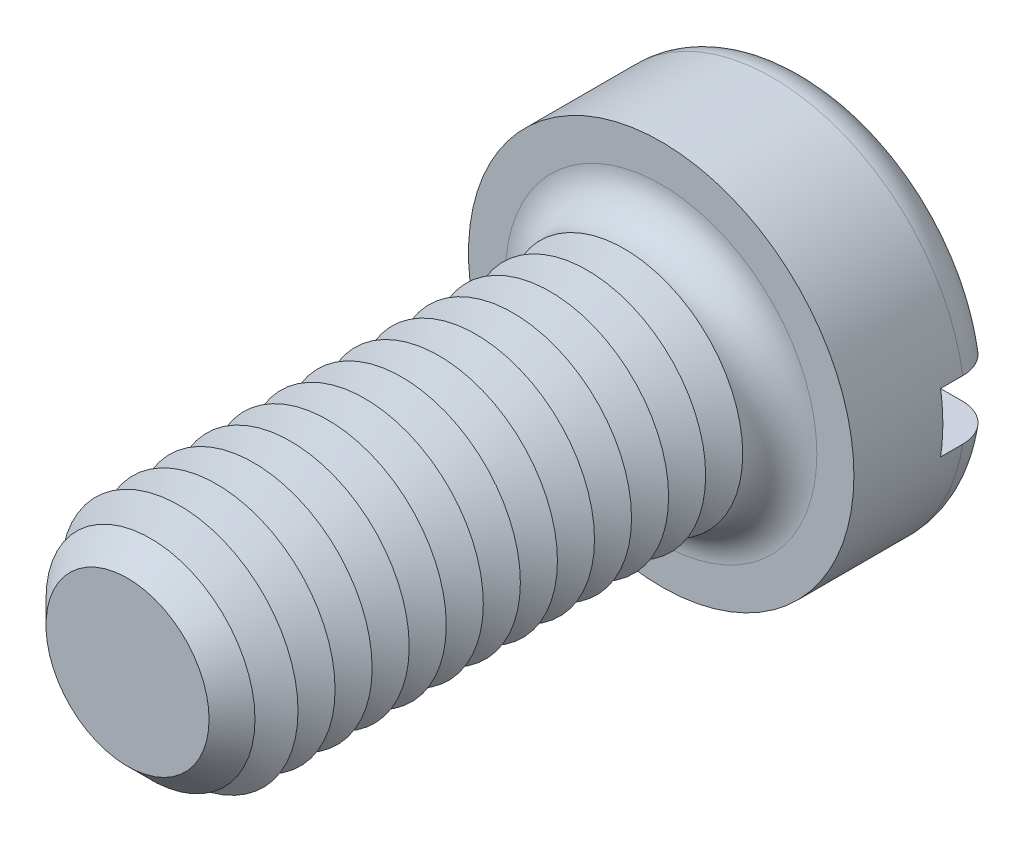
SolidWorks part; units mm, degrees
ref_plane "Front Plane" through (0, 0, 0) normal (0, 0, 1) x (1, 0, 0)
ref_plane "Top Plane" through (0, 0, 0) normal (0, 1, 0) x (1, 0, 0)
ref_plane "Right Plane" through (0, 0, 0) normal (1, 0, 0) x (0, 0, -1)
sketch "Sketch3" plane through (0, 0, 0) normal (0, 0, 1) x (1, 0, 0)
  circle A0 centre (0, 0) radius 6.5
  dimension "D1" = 13
extrude "Boss-Extrude2" add sketch "Sketch3" against normal blind 5
sketch "Sketch4" plane through (0, 0, 0) normal (0, 0, 1) x (1, 0, 0)
  circle A0 centre (0, 0) radius 4
  dimension "D1" = 8
extrude "Boss-Extrude3" add sketch "Sketch4" along normal blind 18
fillet "Fillet1" radius 1.25 2 edges at (6.5, 0, -5) (4, 0, 0)
chamfer "Chamfer1" distance 1.25 angle 45 1 edges at (4, 0, 18)
sketch "Sketch5" plane through (0, 0, 0) normal (1, 0, 0) x (0, 0, -1)
  line L0 (1.6944, 0) -> (-7.6738, 0) construction
sketch "Sketch6" plane through (0, 0, 0) normal (1, 0, 0) x (0, 0, -1)
  line L0 (-1.25, 4) -> (-1.875, 2.9175)
  line L1 (-1.875, 2.9175) -> (-2.5, 4)
  line L2 (-1.25, 4) -> (-16.75, 4) construction
  line L3 (-2.5, 4) -> (-1.25, 4)
  dimension "D1" = 1.25
revolve "Cut-Revolve1" cut sketch "Sketch6" angle 360 about L0
pattern_linear "LPattern1" count 13 spacing 1.25 along (0, 0, 1) of "Cut-Revolve1"
sketch "Sketch8" plane through (0, 0, -5) normal (0, 0, -1) x (-1, 0, 0)
  line L1 (6.5, -1) -> (-6.5, -1)
  line L2 (6.5, -1) -> (6.5, 1)
  line L3 (6.5, 1) -> (-6.5, 1)
  line L4 (-6.5, -1) -> (-6.5, 1)
  line L5 (6.5, -1) -> (-6.5, 1) construction
  line L6 (6.5, 1) -> (-6.5, -1) construction
  point P0 (0, 0)
  dimension "D1" = 13
  dimension "D2" = 2
extrude "Cut-Extrude1" cut sketch "Sketch8" against normal blind 2
